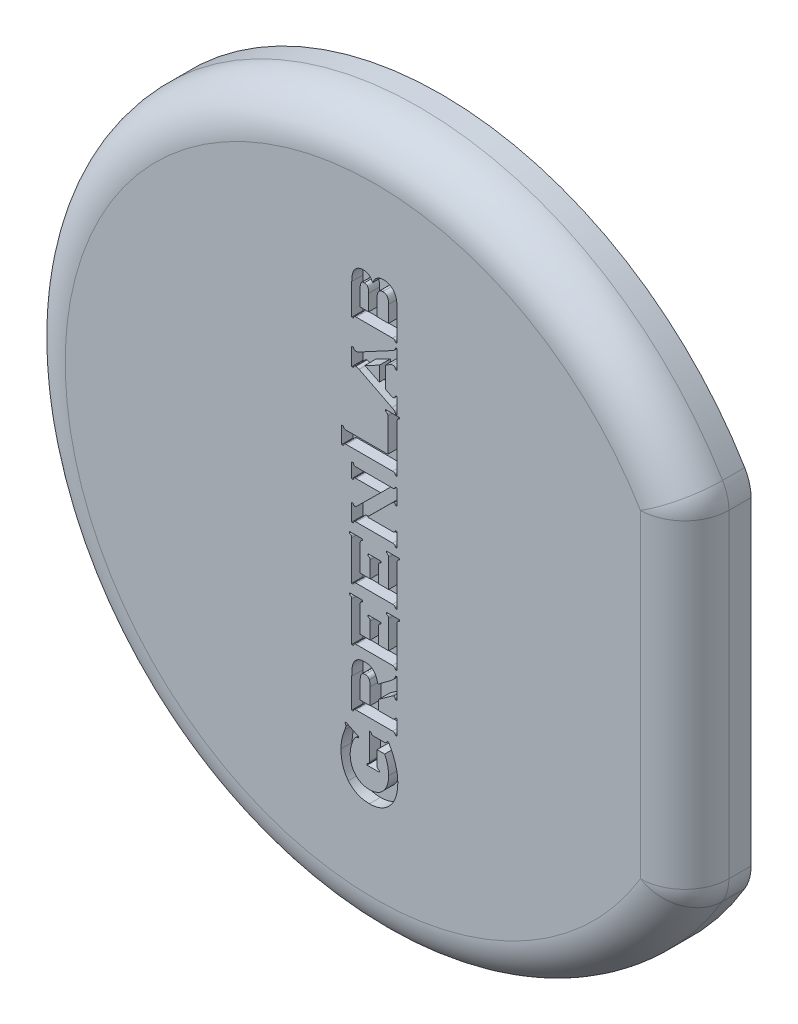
SolidWorks part; units mm, degrees
ref_plane "Front Plane" through (0, 0, 0) normal (0, 0, 1) x (1, 0, 0)
ref_plane "Top Plane" through (0, 0, 0) normal (0, 1, 0) x (1, 0, 0)
ref_plane "Right Plane" through (0, 0, 0) normal (1, 0, 0) x (0, 0, -1)
ref_plane "Plane1" through (0, 0, 3) normal (0, 0, 1) x (1, 0, 0)
sketch "Sketch1" plane through (0, 0, 3) normal (0, 0, 1) x (1, 0, 0)
  line L0 (14, -7.746) -> (14, 7.746)
  arc A0 (14, 7.746) -> (14, -7.746) centre (0, 0) ccw
  dimension "D1" = 16
  dimension "D2" = 14
extrude "Boss-Extrude1" add sketch "Sketch1" against normal blind 3
fillet "Fillet1" radius 2 4 edges at (14, 7.746, 1.5) (14, -7.746, 1.5) (-16, 0, 3) (14, 0, 3)
sketch "Sketch2" plane through (0, 0, 3) normal (0, 0, 1) x (1, 0, 0)
  line L0 (12, 0) -> (50012, 0) construction
  line L1 (12, -7.2111) -> (12, 7.2111) construction
  line L2 (1, 11.7407) -> (1, -11.7407) construction
  line L3 (14, 7.2111) -> (14, -7.2111) construction
  text T0 "GreenLab" font "Copperplate Gothic Bold" height 2.5
  point P4 (12, 0)
  point P8 (1, 0)
  dimension "D1" = 13
extrude "Cut-Extrude1" cut sketch "Sketch2" against normal blind 0.5
